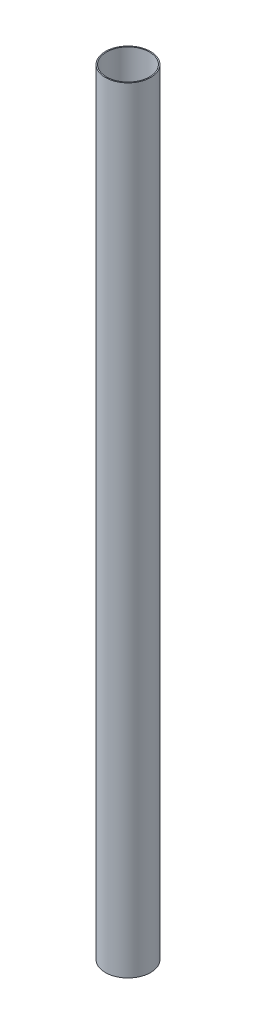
SolidWorks part; units mm, degrees
ref_plane "Front Plane" through (0, 0, 0) normal (0, 0, 1) x (1, 0, 0)
ref_plane "Top Plane" through (0, 0, 0) normal (0, 1, 0) x (1, 0, 0)
ref_plane "Right Plane" through (0, 0, 0) normal (1, 0, 0) x (0, 0, -1)
sketch "Sketch1" plane through (0, 0, 0) normal (0, 1, 0) x (1, 0, 0)
  circle A0 centre (0, 0) radius 50.8
  circle A1 centre (0, 0) radius 53.34
  dimension "D1" = 2.54
  dimension "D2" = 101.6
extrude "Extrude1" add sketch "Sketch1" along normal blind 1828.8
